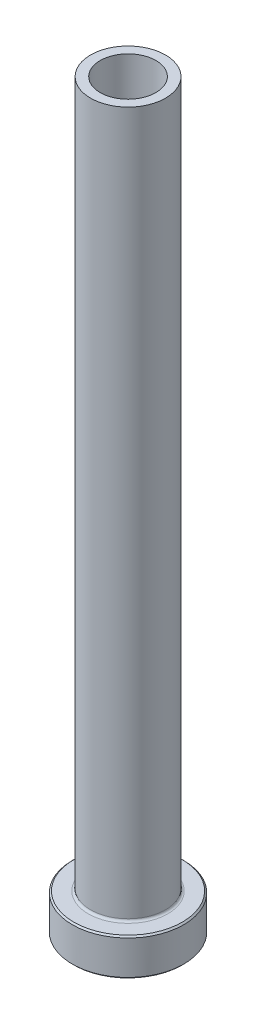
SolidWorks part; units mm, degrees
ref_plane "Front Plane" through (0, 0, 0) normal (0, 0, 1) x (1, 0, 0)
ref_plane "Top Plane" through (0, 0, 0) normal (0, 1, 0) x (1, 0, 0)
ref_plane "Right Plane" through (0, 0, 0) normal (1, 0, 0) x (0, 0, -1)
sketch "Sketch1" plane through (0, 0, 0) normal (0, 0, 1) x (1, 0, 0)
  line L0 (0, 0) -> (0, 50000) construction
  line L1 (0, 0) -> (9.525, 0)
  line L2 (9.525, 0) -> (9.525, 6.35)
  line L3 (9.525, 6.35) -> (6.804, 6.35)
  line L4 (6.4072, 6.7469) -> (6.4072, 127)
  line L5 (6.4072, 127) -> (0, 127)
  line L6 (0, 127) -> (0, 0)
  arc A0 (6.4072, 6.7469) -> (6.804, 6.35) centre (6.804, 6.7469) ccw
  dimension "D5" = 0.3969
  dimension "D1" = 12.8143
  dimension "D2" = 19.05
  dimension "D3" = 6.35
  dimension "D4" = 127
revolve "Revolve1" add sketch "Sketch1" angle 360 about L0
sketch "Sketch2" plane through (0, 0, 0) normal (0, 0, 1) x (1, 0, 0)
  line L0 (0, 0) -> (0, 50000) construction
  line L1 (-9.525, 0) -> (9.525, 0) construction
  line L2 (5.3499, 0) -> (4.953, 0.3969)
  line L3 (4.953, 0.3969) -> (4.953, 52.5145)
  line L4 (4.953, 52.5145) -> (4.7625, 66.802)
  line L5 (4.7625, 66.802) -> (4.7625, 127)
  line L6 (6.4072, 127) -> (-6.4072, 127) construction
  line L7 (4.7625, 127) -> (0, 127)
  line L8 (0, 127) -> (0, 0)
  line L9 (0, 0) -> (5.3499, 0)
  point P4 (0, 0)
  dimension "D1" = 0.3969
  dimension "D2" = 45
  dimension "D3" = 9.525
  dimension "D4" = 9.906
  dimension "D5" = 60.198
  dimension "D6" = 14.2875
revolve "Cut-Revolve1" cut sketch "Sketch2" angle 360 about L0
chamfer "Chamfer1" distance 0.254 angle 45 2 edges at (0, 0, -9.525) (0, 6.35, -9.525)
